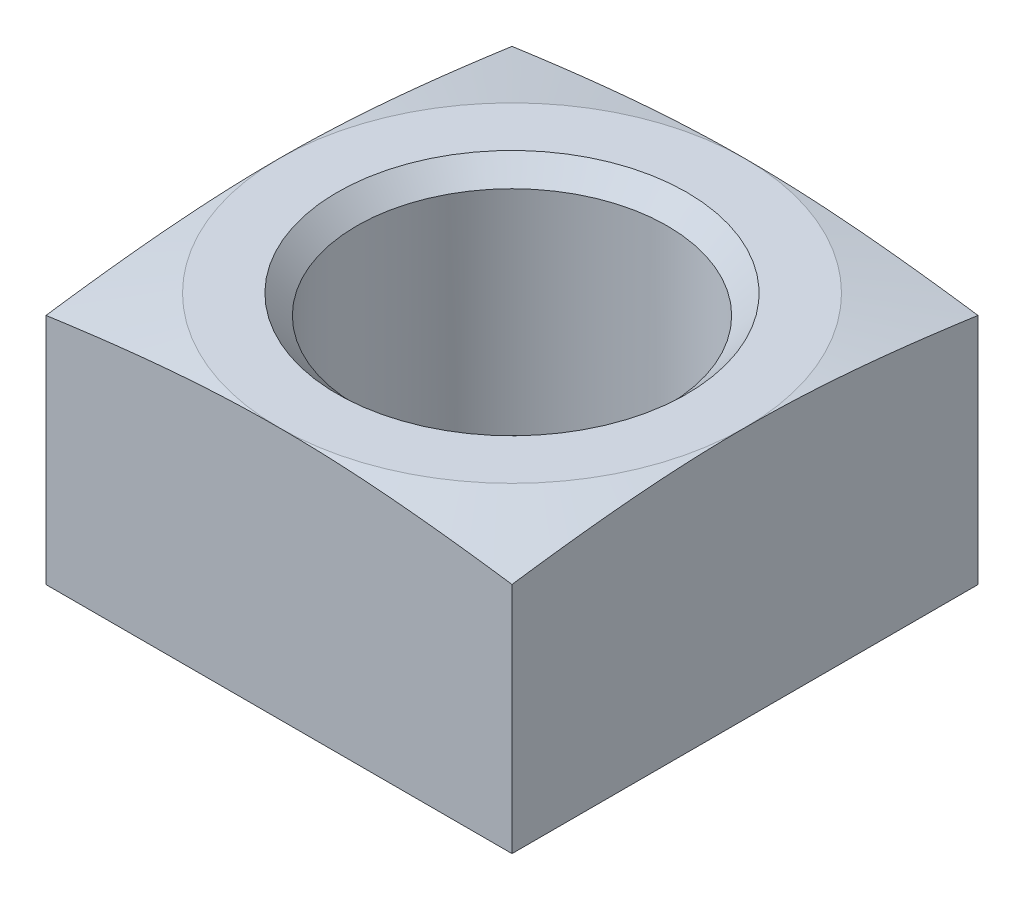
SolidWorks part; units mm, degrees
ref_plane "Front Plane" through (0, 0, 0) normal (0, 0, 1) x (1, 0, 0)
ref_plane "Top Plane" through (0, 0, 0) normal (0, 1, 0) x (1, 0, 0)
ref_plane "Right Plane" through (0, 0, 0) normal (1, 0, 0) x (0, 0, -1)
sketch "Sketch6" plane through (0, 0, 0) normal (1, 0, 0) x (0, 0, -1)
  line L0 (0, 59.8384) -> (0, -60.7908) construction
sketch "Sketch8" plane through (0, 0, 0) normal (1, 0, 0) x (0, 0, -1)
  line L1 (12, 6.5) -> (-12, 6.5)
  line L2 (12, 6.5) -> (12, -6.5)
  line L3 (12, -6.5) -> (-12, -6.5)
  line L4 (-12, 6.5) -> (-12, -6.5)
  line L5 (12, 6.5) -> (-12, -6.5) construction
  line L6 (12, -6.5) -> (-12, 6.5) construction
  point P0 (0, 0)
  dimension "D1" = 13
  dimension "D2" = 24
extrude "Boss-Extrude2" add sketch "Sketch8" along normal mid plane 24
sketch "Sketch10" plane through (0, 0, 0) normal (1, 0, 0) x (0, 0, -1)
  line L0 (-12, 6.5) -> (-17, 6.5)
  line L1 (-17, 6.5) -> (-17, 5.5)
  line L2 (-17, 5.5) -> (-12, 6.5)
  point P0 (-12, 6.5)
  point P6 (-12, 6.5)
  dimension "D1" = 1
  dimension "D2" = 5
revolve "Cut-Revolve1" cut sketch "Sketch10" angle 360 about L0
sketch "Sketch11" plane through (0, 6.5, 0) normal (0, 1, 0) x (1, 0, 0)
  circle A0 centre (0, 0) radius 8
  dimension "D1" = 16
extrude "Cut-Extrude1" cut sketch "Sketch11" against normal up to surface (13 mm away)
chamfer "Chamfer1" distance 1 angle 45 2 edges at (0, 6.5, 8) (0, -6.5, 8)
